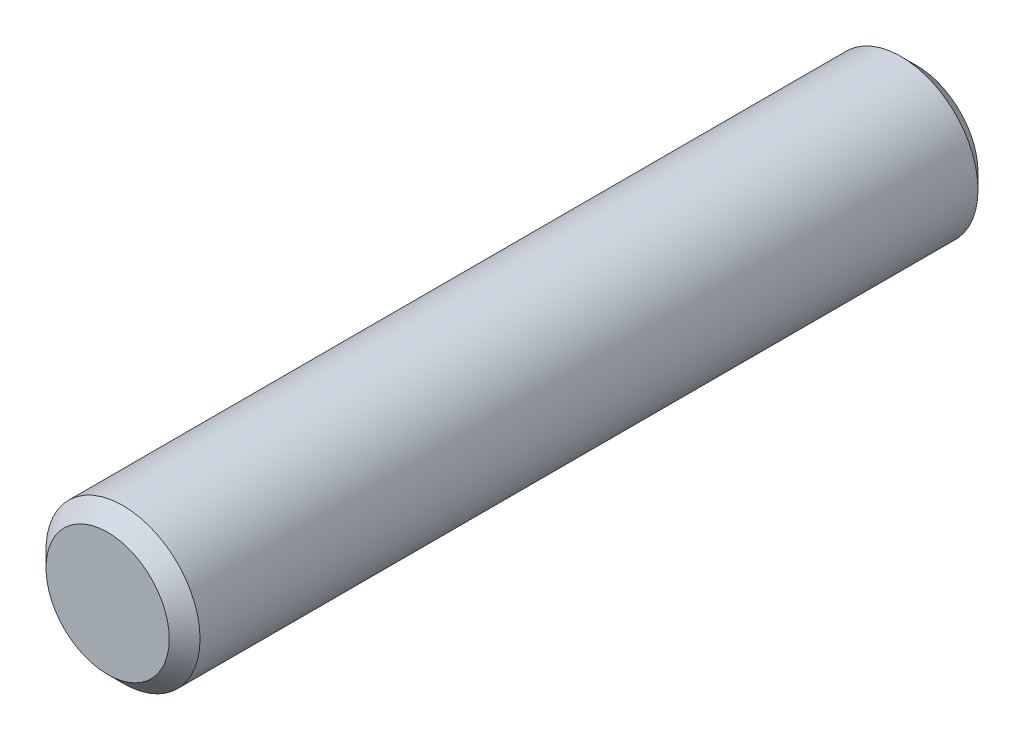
SolidWorks part; units mm, degrees
ref_plane "Plan de face" through (0, 0, 0) normal (0, 0, 1) x (1, 0, 0)
ref_plane "Plan de dessus" through (0, 0, 0) normal (0, 1, 0) x (1, 0, 0)
ref_plane "Plan de droite" through (0, 0, 0) normal (1, 0, 0) x (0, 0, -1)
sketch "Esquisse1" plane through (0, 0, 0) normal (0, 0, 1) x (1, 0, 0)
  circle A0 centre (0, 0) radius 10
  dimension "D1" = 20
extrude "Extrusion1" add sketch "Esquisse1" along normal blind 105
chamfer "Chanfrein1" distance 2 angle 45 2 edges at (10, 0, 0) (10, 0, 105)
